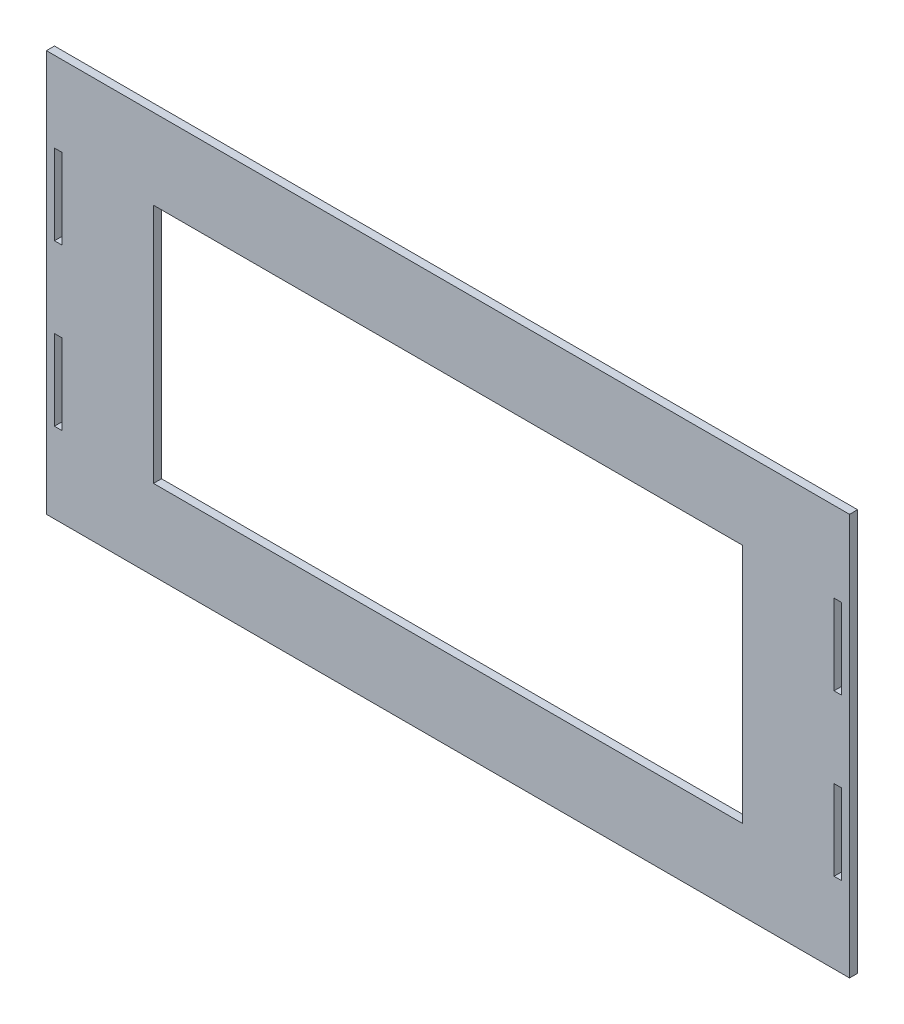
SolidWorks part; units mm, degrees
ref_plane "Alzado" through (0, 0, 0) normal (0, 0, 1) x (1, 0, 0)
ref_plane "Planta" through (0, 0, 0) normal (0, 1, 0) x (1, 0, 0)
ref_plane "Vista lateral" through (0, 0, 0) normal (1, 0, 0) x (0, 0, -1)
sketch "Croquis1" plane through (0, 0, 0) normal (0, 0, 1) x (1, 0, 0)
  line L0 (0, 0) -> (0, 75) construction
  line L1 (-150, -75) -> (150, -75)
  line L2 (-150, -75) -> (-150, 75)
  line L3 (-150, 75) -> (150, 75)
  line L4 (150, -75) -> (150, 75)
  line L5 (-150, -75) -> (150, 75) construction
  line L6 (-150, 75) -> (150, -75) construction
  line L7 (-110, -45) -> (110, -45)
  line L8 (-110, -45) -> (-110, 45)
  line L9 (-110, 45) -> (110, 45)
  line L10 (110, -45) -> (110, 45)
  line L11 (-110, -45) -> (110, 45) construction
  line L12 (-110, 45) -> (110, -45) construction
  line L13 (-147, 45) -> (-144.2, 45)
  line L14 (-147, 45) -> (-147, 15)
  line L15 (-147, 15) -> (-144.2, 15)
  line L16 (-144.2, 45) -> (-144.2, 15)
  line L17 (-147, -15) -> (-144.2, -15)
  line L18 (-147, -15) -> (-147, -45)
  line L19 (-147, -45) -> (-144.2, -45)
  line L20 (-144.2, -15) -> (-144.2, -45)
  line L21 (147, -45) -> (144.2, -45)
  line L22 (144.2, -15) -> (144.2, -45)
  line L23 (147, -15) -> (144.2, -15)
  line L24 (147, -15) -> (147, -45)
  line L25 (147, 15) -> (144.2, 15)
  line L26 (144.2, 45) -> (144.2, 15)
  line L27 (147, 45) -> (144.2, 45)
  line L28 (147, 45) -> (147, 15)
  point P0 (0, 0)
  point P6 (0, 0)
  point P29 (0, 0)
  dimension "D1" = 300
  dimension "D2" = 150
  dimension "D3" = 30
  dimension "D4" = 30
  dimension "D5" = 2.8
  dimension "D6" = 30
  dimension "D7" = 2.8
  dimension "D8" = 30
  dimension "D9" = 3
  dimension "D10" = 3
  dimension "D11" = 90
  dimension "D12" = 220
extrude "Saliente-Extruir1" add sketch "Croquis1" along normal blind 3
